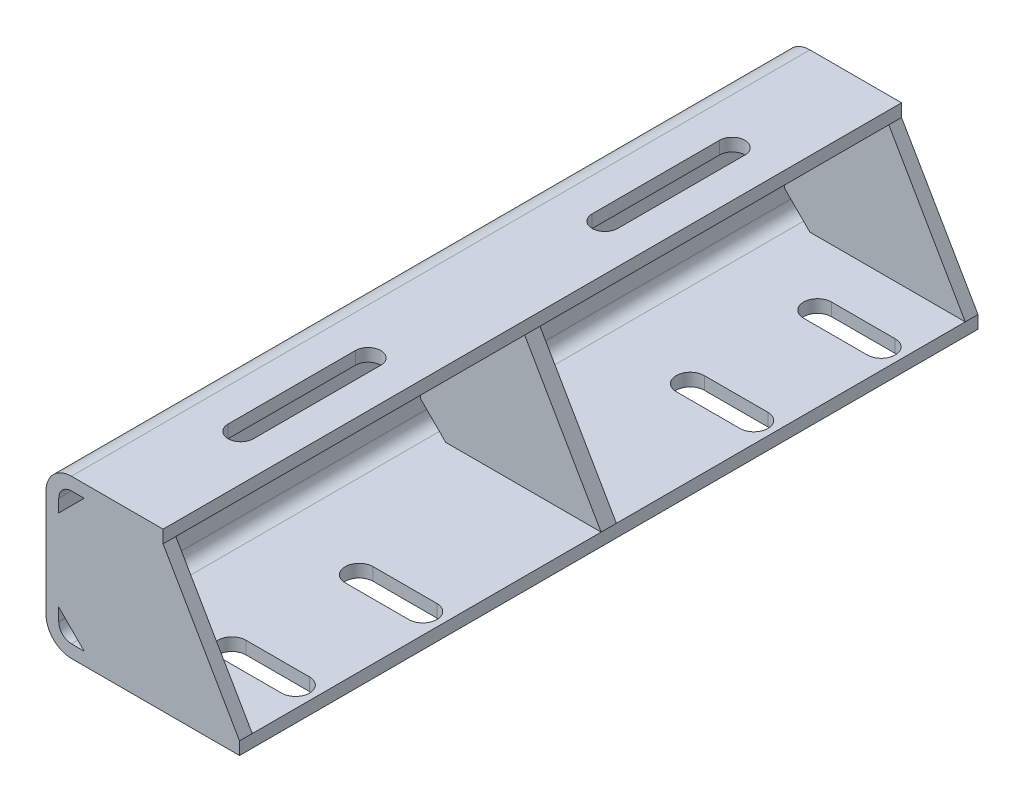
SolidWorks part; units mm, degrees
ref_plane "Plan de face" through (0, 0, 0) normal (0, 0, 1) x (1, 0, 0)
ref_plane "Plan de dessus" through (0, 0, 0) normal (0, 1, 0) x (1, 0, 0)
ref_plane "Plan de droite" through (0, 0, 0) normal (1, 0, 0) x (0, 0, -1)
sketch "Esquisse1" plane through (0, 0, 0) normal (0, 0, 1) x (1, 0, 0)
  line L0 (71, 5) -> (76, 5)
  line L1 (10, 0) -> (76, 0)
  line L2 (0, 10) -> (0, 52)
  line L3 (10, 62) -> (45.9778, 62)
  line L4 (76, 0) -> (76, 5)
  line L5 (10, 57) -> (45.9778, 57)
  line L6 (5, 52) -> (5, 10)
  line L7 (10, 5) -> (71, 5)
  line L9 (45.9778, 62) -> (45.9778, 57)
  line L10 (76, 5) -> (45.9778, 57) construction
  arc A0 (0, 52) -> (10, 62) centre (10, 52) cw
  arc A1 (10, 0) -> (0, 10) centre (10, 10) cw
  arc A2 (10, 57) -> (5, 52) centre (10, 52) ccw
  arc A3 (5, 10) -> (10, 5) centre (10, 10) ccw
  point P13 (0, 0)
  dimension "D7" = 10
  dimension "D8" = 5
  dimension "D1" = 76
  dimension "D2" = 62
  dimension "D3" = 5
  dimension "D4" = 5
  dimension "D5" = 5
  dimension "D9" = 60
extrude "Boss.-Extru.2" add sketch "Esquisse1" along normal blind 290
sketch "Esquisse2" plane through (0, 0, 290) normal (0, 0, 1) x (1, 0, 0)
  line L0 (10, 57) -> (45.9778, 57) construction
  line L1 (15, 57) -> (45.9778, 57)
  line L2 (5, 47) -> (5, 15)
  line L3 (15, 5) -> (76, 5)
  line L5 (76, 5) -> (10, 5) construction
  line L6 (5, 10) -> (5, 52) construction
  line L7 (15, 57) -> (5, 47)
  line L8 (5, 15) -> (15, 5)
  line L9 (45.9778, 57) -> (76, 5)
  point P0 (5, 57)
  point P2 (5, 5)
extrude "Boss.-Extru.3" add sketch "Esquisse2" against normal blind 5
pattern_linear "Répétition linéaire1" count 2 spacing 143 along (0, 0, -1) of "Boss.-Extru.3"
pattern_linear "Répétition linéaire2" count 2 spacing 142 along (0, 0, -1) of "Répétition linéaire1", "Boss.-Extru.3"
sketch "Esquisse3" plane through (0, 62, 0) normal (0, 1, 0) x (1, 0, 0)
  line L0 (27.9889, 0) -> (27.9889, -290) construction
  line L1 (45.9778, 0) -> (10, 0) construction
  line L2 (45.9778, -290) -> (10, -290) construction
  line L3 (27.9889, -48.5) -> (27.9889, -98.5) construction
  line L4 (32.9889, -48.5) -> (32.9889, -98.5)
  line L5 (22.9889, -48.5) -> (22.9889, -98.5)
  line L6 (27.9889, -191.5) -> (27.9889, -241.5) construction
  line L7 (32.9889, -191.5) -> (32.9889, -241.5)
  line L8 (22.9889, -191.5) -> (22.9889, -241.5)
  line L14 (45.5, -5) -> (10, -5) construction
  line L15 (15, -5) -> (76, -5) construction
  line L16 (10, -290) -> (10, 0) construction
  line L17 (45.9778, -285) -> (10, -285) construction
  arc A0 (32.9889, -48.5) -> (22.9889, -48.5) centre (27.9889, -48.5) ccw
  arc A1 (22.9889, -98.5) -> (32.9889, -98.5) centre (27.9889, -98.5) ccw
  arc A2 (32.9889, -191.5) -> (22.9889, -191.5) centre (27.9889, -191.5) ccw
  arc A3 (22.9889, -241.5) -> (32.9889, -241.5) centre (27.9889, -241.5) ccw
  point P8 (27.9889, -73.5)
  point P13 (27.9889, -216.5)
  dimension "D1" = 5
  dimension "D4" = 5
  dimension "D2" = 50
  dimension "D3" = 68.5
  dimension "D5" = 50
  dimension "D6" = 68.5
extrude "Enlèv. mat.-Extru.1" cut sketch "Esquisse3" against normal blind 10
sketch "Esquisse4" plane through (0, 0, 0) normal (0, -1, 0) x (1, 0, 0)
  line L0 (43, 290) -> (43, 0) construction
  line L1 (10, 290) -> (76, 290) construction
  line L2 (10, 0) -> (76, 0) construction
  line L3 (43, 260) -> (68, 260) construction
  line L4 (43, 265.5) -> (68, 265.5)
  line L5 (43, 254.5) -> (68, 254.5)
  line L6 (43, 80) -> (68, 80) construction
  line L7 (43, 85.5) -> (68, 85.5)
  line L8 (43, 74.5) -> (68, 74.5)
  line L10 (43, 30) -> (68, 30) construction
  line L11 (43, 35.5) -> (68, 35.5)
  line L12 (43, 24.5) -> (68, 24.5)
  line L13 (43, 210) -> (68, 210) construction
  line L14 (43, 215.5) -> (68, 215.5)
  line L15 (43, 204.5) -> (68, 204.5)
  arc A0 (43, 265.5) -> (43, 254.5) centre (43, 260) ccw
  arc A1 (68, 254.5) -> (68, 265.5) centre (68, 260) ccw
  arc A2 (43, 85.5) -> (43, 74.5) centre (43, 80) ccw
  arc A3 (68, 74.5) -> (68, 85.5) centre (68, 80) ccw
  arc A4 (43, 35.5) -> (43, 24.5) centre (43, 30) ccw
  arc A5 (68, 24.5) -> (68, 35.5) centre (68, 30) ccw
  arc A6 (43, 215.5) -> (43, 204.5) centre (43, 210) ccw
  arc A7 (68, 204.5) -> (68, 215.5) centre (68, 210) ccw
  point P8 (55.5, 260)
  point P13 (55.5, 80)
  point P22 (55.5, 30)
  point P27 (55.5, 210)
  dimension "D3" = 5.5
  dimension "D4" = 25
  dimension "D5" = 30
  dimension "D1" = 180
  dimension "D2" = 30
  dimension "D6" = 180
extrude "Enlèv. mat.-Extru.2" cut sketch "Esquisse4" against normal blind 10
